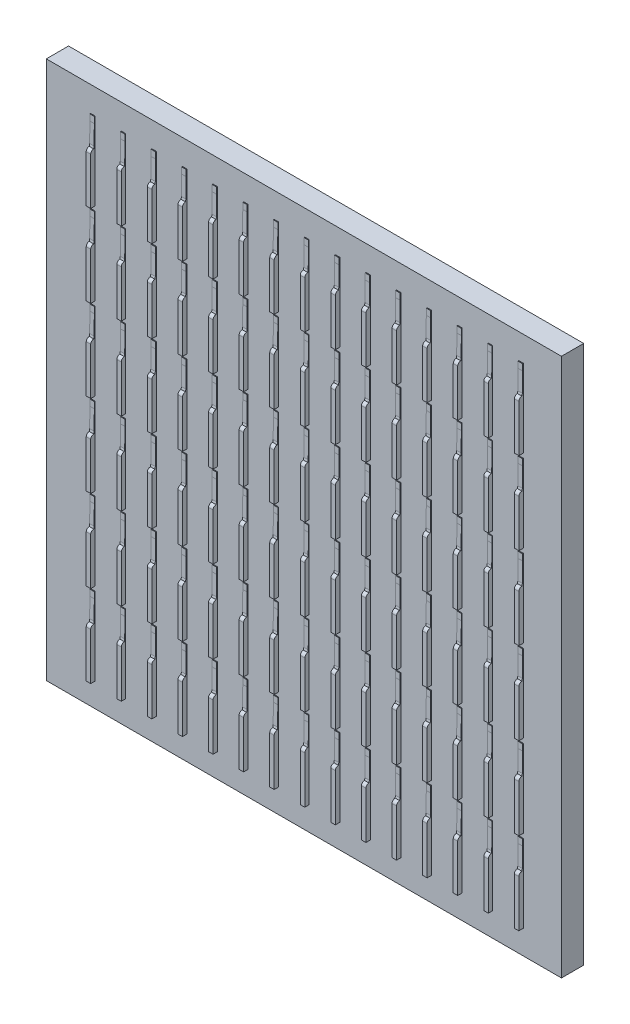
SolidWorks part; units mm, degrees
ref_plane "前视基准面" through (0, 0, 0) normal (0, 0, 1) x (1, 0, 0)
ref_plane "上视基准面" through (0, 0, 0) normal (0, 1, 0) x (1, 0, 0)
ref_plane "右视基准面" through (0, 0, 0) normal (1, 0, 0) x (0, 0, -1)
sketch "草图1" plane through (0, 0, 0) normal (0, 0, 1) x (1, 0, 0)
  line L9 (-172.4818, -76.7058) -> (-171.6818, -76.7058)
  line L10 (-171.6818, -76.7058) -> (-171.6818, -62.7058)
  line L11 (-171.6818, -62.7058) -> (-172.4818, -62.7058)
  line L12 (-172.4818, -76.7058) -> (-172.4818, -62.7058)
extrude "凸台-拉伸1" add sketch "草图1" along normal blind 0.8
ref_plane "基准面4" through (-171.6818, 0, 0) normal (1, 0, 0) x (0, 0, -1)
sketch "草图5" plane through (-171.6818, 0, 0) normal (1, 0, 0) x (0, 0, -1)
  line L22 (-0.8, -67.7058) -> (-0.25, -67.7058)
  line L24 (-0.8, -76.7058) -> (-0.8, -62.7058) construction
  line L25 (-0.15, -63.8184) -> (-0.15, -62.7058)
  line L26 (-0.8, -62.7058) -> (0, -62.7058) construction
  line L27 (-0.15, -62.7058) -> (-0.8, -62.7058)
  line L28 (-0.8, -62.7058) -> (-0.8, -67.7058)
  line L30 (-0.15, -63.8184) -> (-0.18, -67.3058)
  line L31 (-0.18, -67.3058) -> (-0.25, -67.7058)
extrude "切除-拉伸4" cut sketch "草图5" against normal blind 0.9
fillet "圆角3" radius 0.55 1 edges at (-172.0818, -67.7058, 0.8)
pattern_linear "阵列(线性)10" count 15 spacing 5.5 along (-1, 0, 0) count 6 spacing 14.8 along (0, 1, 0)
sketch "草图9" plane through (0, 0, 0) normal (0, 0, 1) x (1, 0, 0)
  line L0 (-164.8219, -81.0207) -> (-257.4624, -81.0207)
  line L6 (-257.4624, 15.8056) -> (-164.8219, 15.8056)
  line L35 (-164.8219, 15.8056) -> (-164.8219, -81.0207)
  line L36 (-164.8219, -81.0207) -> (-164.8219, 15.8056)
  line L37 (-164.8219, 15.8056) -> (-257.4624, 15.8056)
  line L38 (-257.4624, 15.8056) -> (-257.4624, -81.0207)
  line L39 (-257.4624, -81.0207) -> (-164.8219, -81.0207)
  line L40 (-164.8219, 15.8056) -> (-164.8219, -81.0207)
extrude "凸台-拉伸3" add sketch "草图9" against normal blind 4 contours L6 L38 L0 L35
